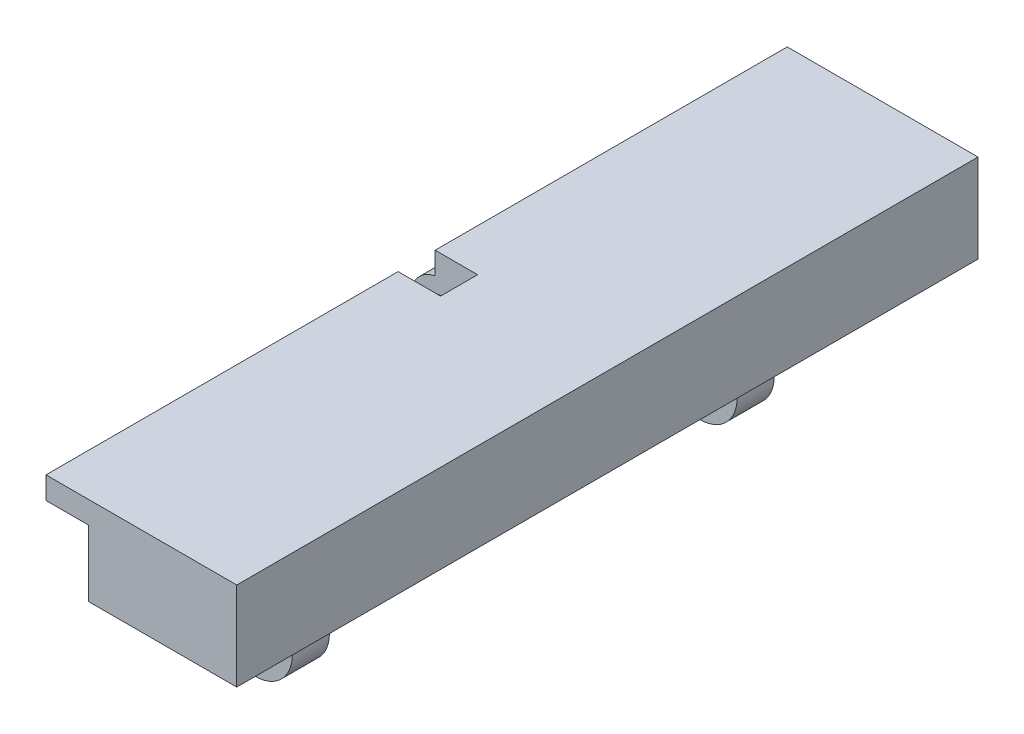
SolidWorks part; units mm, degrees
ref_plane "Plan de face" through (0, 0, 0) normal (0, 0, 1) x (1, 0, 0)
ref_plane "Plan de dessus" through (0, 0, 0) normal (0, 1, 0) x (1, 0, 0)
ref_plane "Plan de droite" through (0, 0, 0) normal (1, 0, 0) x (0, 0, -1)
sketch "Esquisse1" plane through (0, 0, 0) normal (0, 0, 1) x (1, 0, 0)
  line L1 (-100, 0) -> (100, 0)
  line L2 (-100, 0) -> (-100, 100)
  line L3 (-100, 100) -> (100, 100)
  line L4 (100, 0) -> (100, 100)
  dimension "D1" = 100
  dimension "D2" = 200
  dimension "D3" = 100
extrude "Boss.-Extru.1" add sketch "Esquisse1" along normal mid plane 1000
ref_plane "Plan1" through (0, 0, 300) normal (0, 0, 1) x (1, 0, 0)
sketch "Esquisse2" plane through (0, 0, 300) normal (0, 0, 1) x (1, 0, 0)
  line L1 (0, 0) -> (0, -100)
  line L2 (-100, 0) -> (0, 0)
  line L3 (-100, 0) -> (-100, -100)
  arc A0 (-100, -100) -> (0, -100) centre (-50, -100) ccw
extrude "Boss.-Extru.2" add sketch "Esquisse2" along normal mid plane 50
mirror "Symétrie1" about plane through (0, 0, 0) normal (0, 0, 1) of "Boss.-Extru.2"
sketch "Esquisse3" plane through (0, 0, -325) normal (0, 0, -1) x (-1, 0, 0)
  circle A0 centre (50, -100) radius 30
extrude "Enlèv. mat.-Extru.1" cut sketch "Esquisse3" against normal through all
fillet "Congé2" radius 50 2 edges at (0, 0, 300) (0, 0, -300)
ref_plane "Plan2" through (0, 0, 50) normal (0, 0, 1) x (1, 0, 0)
sketch "Esquisse4" plane through (0, 0, 50) normal (0, 0, 1) x (1, 0, 0)
  line L0 (-100, 100) -> (-157.3238, 89.3238)
  line L1 (100, 100) -> (-100, 100) construction
  line L2 (-100, 100) -> (-100, 0) construction
  line L3 (-100, 0) -> (-157.3238, 10.6762)
  line L4 (-100, 100) -> (-100, 0)
  arc A0 (-157.3238, 89.3238) -> (-157.3238, 10.6762) centre (-150, 50) ccw
  dimension "D1" = 50
  dimension "D2" = 50
  dimension "D3" = 80
extrude "Boss.-Extru.3" add sketch "Esquisse4" along normal mid plane 50
mirror "Symétrie2" about plane through (0, 0, 0) normal (0, 0, 1) of "Boss.-Extru.3"
sketch "Esquisse5" plane through (0, 0, 75) normal (0, 0, 1) x (1, 0, 0)
  circle A0 centre (-150, 50) radius 20
extrude "Enlèv. mat.-Extru.2" cut sketch "Esquisse5" against normal through all
sketch "Esquisse6" plane through (0, 0, 500) normal (0, 0, 1) x (1, 0, 0)
  line L1 (-100, 100) -> (-157.3238, 100)
  line L2 (-100, 100) -> (-100, 89.3238)
  line L3 (-100, 89.3238) -> (-157.3238, 89.3238)
  line L4 (-157.3238, 100) -> (-157.3238, 89.3238)
extrude "Boss.-Extru.4" add sketch "Esquisse6" against normal blind 1000
sketch "Esquisse7" plane through (0, 0, 500) normal (0, 0, 1) x (1, 0, 0)
  line L1 (-157.3238, 89.3238) -> (100, 89.3238)
  line L2 (-157.3238, 89.3238) -> (-157.3238, 119.3238)
  line L3 (-157.3238, 119.3238) -> (100, 119.3238)
  line L4 (100, 89.3238) -> (100, 119.3238)
  dimension "D1" = 30
extrude "Boss.-Extru.5" add sketch "Esquisse7" against normal blind 1000
sketch "Esquisse8" plane through (0, 89.3238, 0) normal (0, -1, 0) x (1, 0, 0)
  line L1 (-258.0912, 25) -> (-100, 25)
  line L2 (-258.0912, 25) -> (-258.0912, -25)
  line L3 (-258.0912, -25) -> (-100, -25)
  line L4 (-100, 25) -> (-100, -25)
extrude "Enlèv. mat.-Extru.3" cut sketch "Esquisse8" against normal through all
